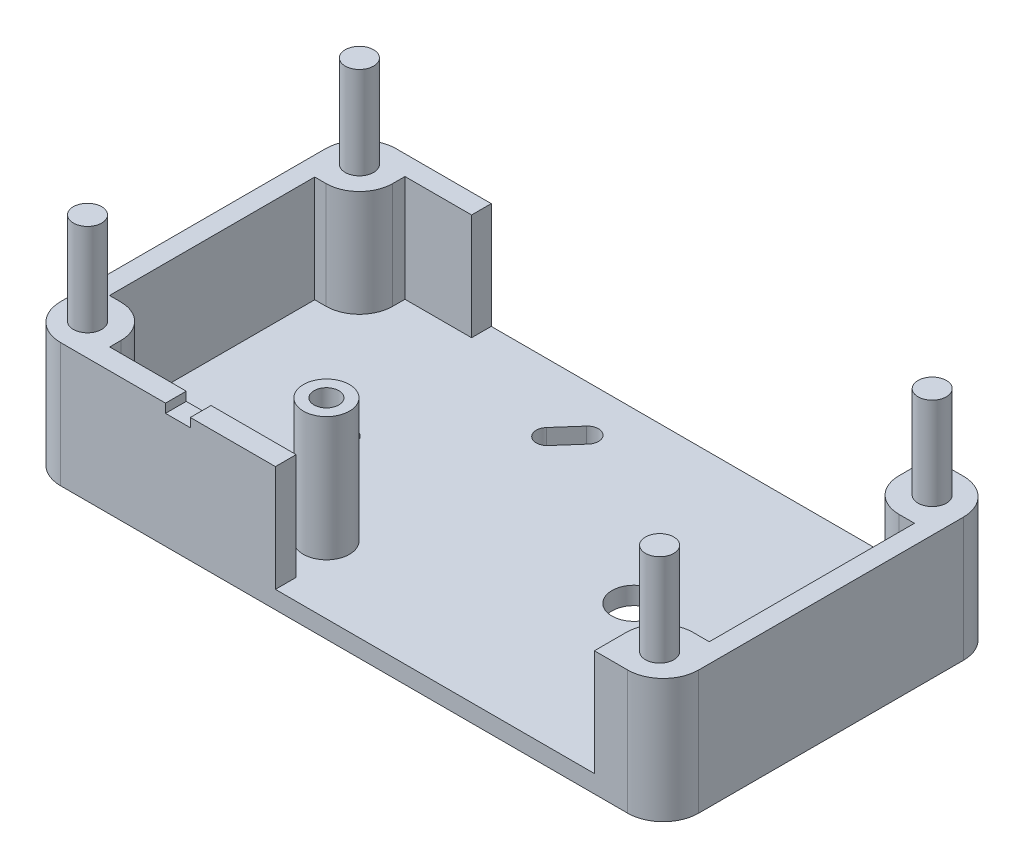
SolidWorks part; units mm, degrees
ref_plane "Front Plane" through (0, 0, 0) normal (0, 0, 1) x (1, 0, 0)
ref_plane "Top Plane" through (0, 0, 0) normal (0, 1, 0) x (1, 0, 0)
ref_plane "Right Plane" through (0, 0, 0) normal (1, 0, 0) x (0, 0, -1)
sketch "Sketch1" plane through (0, 0, 0) normal (0, 1, 0) x (1, 0, 0)
  line L1 (-22.86, 12.0269) -> (22.86, 12.0269)
  line L2 (-22.86, 12.0269) -> (-22.86, -12.0269)
  line L3 (-22.86, -12.0269) -> (22.86, -12.0269)
  line L4 (22.86, 12.0269) -> (22.86, -12.0269)
  line L5 (-22.86, 12.0269) -> (22.86, -12.0269) construction
  line L6 (-22.86, -12.0269) -> (22.86, 12.0269) construction
  point P0 (0, 0)
  dimension "D1" = 45.72
  dimension "D2" = 24.0538
extrude "Boss-Extrude1" add sketch "Sketch1" along normal blind 8.89
fillet "Fillet1" radius 2.54 4 edges at (22.86, 4.445, -12.0269) (-22.86, 4.445, -12.0269) (-22.86, 4.445, 12.0269) (22.86, 4.445, 12.0269)
sketch "Sketch2" plane through (0, 8.89, 0) normal (0, 1, 0) x (1, 0, 0)
  line L0 (-22.86, 9.4869) -> (-22.86, -9.4869) construction
  line L1 (-21.4884, 7.3533) -> (21.4884, 7.3533)
  line L2 (-21.4884, 7.3533) -> (-21.4884, -7.3533)
  line L3 (-21.4884, -7.3533) -> (21.4884, -7.3533)
  line L4 (21.4884, 7.3533) -> (21.4884, -7.3533)
  line L5 (-21.4884, 7.3533) -> (21.4884, -7.3533) construction
  line L6 (-21.4884, -7.3533) -> (21.4884, 7.3533) construction
  line L8 (20.32, 12.0269) -> (-20.32, 12.0269) construction
  point P0 (0, 0)
  dimension "D1" = 1.3716
  dimension "D2" = 4.6736
extrude "Cut-Extrude1" cut sketch "Sketch2" against normal blind 7.62
sketch "Sketch3" plane through (0, 0, -12.0269) normal (0, 0, -1) x (-1, 0, 0)
  line L0 (-20.32, 8.89) -> (-20.32, 0) construction
  line L5 (-20.32, 8.89) -> (20.32, 8.89) construction
  line L14 (-17.9832, 8.89) -> (13.5128, 8.89)
  line L15 (-17.9832, 8.89) -> (-17.9832, 1.27)
  line L16 (-17.9832, 1.27) -> (13.5128, 1.27)
  line L18 (13.5128, 1.27) -> (13.5128, 8.89)
  dimension "D1" = 31.496
  dimension "D4" = 2.3368
  dimension "D5" = 7.62
sketch "Sketch4" plane through (0, 0, 12.0269) normal (0, 0, 1) x (1, 0, 0)
  line L0 (-20.32, 8.89) -> (20.32, 8.89) construction
  line L9 (20.32, 0) -> (20.32, 8.89) construction
  line L10 (-4.9276, 8.89) -> (17.9324, 8.89)
  line L11 (-4.9276, 8.89) -> (-4.9276, 1.27)
  line L12 (-4.9276, 1.27) -> (17.9324, 1.27)
  line L13 (17.9324, 8.89) -> (17.9324, 1.27)
  dimension "D1" = 2.3876
  dimension "D2" = 22.86
  dimension "D3" = 7.62
extrude "Cut-Extrude3" cut sketch "Sketch4" against normal blind 7.366
extrude "Cut-Extrude4" cut sketch "Sketch3" against normal blind 7.366
fillet "Fillet3" radius 2.3876 2 edges at (17.9324, 5.08, 7.3533) (17.9832, 5.08, -7.3533)
sketch "Sketch5" plane through (0, 8.89, 0) normal (0, 1, 0) x (1, 0, 0)
  line L0 (-20.32, -12.0269) -> (-4.9276, -12.0269) construction
  line L1 (-18.288, 10.6172) -> (-3.048, 10.6172)
  line L2 (-18.288, 10.6172) -> (-18.288, -10.541)
  line L3 (-18.288, -10.541) -> (-3.048, -10.541)
  line L4 (-3.048, 10.6172) -> (-3.048, -10.541)
  line L5 (-22.86, 9.4869) -> (-22.86, -9.4869) construction
  line L6 (-13.5128, 7.3533) -> (-13.5128, 12.0269) construction
  dimension "D1" = 21.1582
  dimension "D2" = 1.4859
  dimension "D3" = 4.572
  dimension "D4" = 15.24
other "AlignGroup1"
extrude "Cut-Extrude5" cut sketch "Sketch5" against normal blind 7.62
fillet "Fillet4" radius 2.3876 2 edges at (-18.288, 5.08, -7.3533) (-18.288, 5.08, 7.3533)
sketch "Sketch6" plane through (0, 8.89, 0) normal (0, 1, 0) x (1, 0, 0)
  circle A0 centre (-20.6756, 9.7409) radius 1.016
  circle A2 centre (20.3708, 9.7409) radius 1.016
  circle A3 centre (20.32, -9.7409) radius 1.016
  circle A4 centre (-20.6756, -9.7409) radius 1.016
  dimension "D1" = 2.032
  dimension "D2" = 2.032
  dimension "D3" = 2.032
  dimension "D4" = 2.032
extrude "Boss-Extrude2" add sketch "Sketch6" along normal blind 6.604
sketch "Sketch7" plane through (0, 0, 12.0269) normal (0, 0, 1) x (1, 0, 0)
  line L0 (-20.32, 8.89) -> (-4.9276, 8.89) construction
  line L1 (-12.8016, 8.89) -> (-11.0236, 8.89)
  line L2 (-12.8016, 8.89) -> (-12.8016, 8.255)
  line L3 (-12.8016, 8.255) -> (-11.0236, 8.255)
  line L4 (-11.0236, 8.89) -> (-11.0236, 8.255)
  line L5 (-4.9276, 8.89) -> (-4.9276, 1.27) construction
  dimension "D1" = 1.778
  dimension "D2" = 6.096
  dimension "D3" = 0.635
extrude "Cut-Extrude6" cut sketch "Sketch7" against normal blind 26.67
sketch "Sketch8" plane through (0, 1.27, 0) normal (0, 1, 0) x (1, 0, 0)
  line L0 (21.4884, -7.3533) -> (21.4884, 7.3533) construction
  line L1 (17.9832, 12.0269) -> (-13.5128, 12.0269) construction
  circle A0 centre (8.7884, -0.0381) radius 1.5875
  dimension "D1" = 3.175
  dimension "D2" = 12.7
  dimension "D3" = 12.065
extrude "Cut-Extrude7" cut sketch "Sketch8" against normal blind 26.67
sketch "Sketch9" plane through (0, 1.27, 0) normal (0, 1, 0) x (1, 0, 0)
  line L0 (-4.6675, 7.2009) -> (-3.3235, 8.7249) construction
  line L1 (-5.2628, 7.7259) -> (-3.9188, 9.2499)
  line L2 (-4.0722, 6.6759) -> (-2.7282, 8.1999)
  line L4 (17.9832, 12.0269) -> (-13.5128, 12.0269) construction
  arc A0 (-5.2628, 7.7259) -> (-4.0722, 6.6759) centre (-4.6675, 7.2009) ccw
  arc A1 (-2.7282, 8.1999) -> (-3.9188, 9.2499) centre (-3.3235, 8.7249) ccw
  circle A2 centre (8.7884, -0.0381) radius 1.5875
  point P2 (-3.9955, 7.9629)
  dimension "D3" = 0.7937
  dimension "D6" = 3.175
  dimension "D1" = 2.032
  dimension "D2" = 15.0812
  dimension "D4" = 4.064
  dimension "D5" = 4.826
extrude "Cut-Extrude8" cut sketch "Sketch9" against normal blind 26.67
sketch "Sketch10" plane through (0, 1.27, 0) normal (0, 1, 0) x (1, 0, 0)
  line L0 (-3.9188, 9.2499) -> (-5.2628, 7.7259)
  line L1 (17.9832, 12.0269) -> (-13.5128, 12.0269) construction
  line L2 (-2.7282, 8.1999) -> (-4.0722, 6.6759)
  line L3 (-3.3235, 8.7249) -> (-3.9955, 7.9629)
  line L4 (-4.5908, 8.4879) -> (-3.4002, 7.4379)
  circle A0 centre (-11.9594, -0.0381) radius 0.7937
  arc A1 (-5.2628, 7.7259) -> (-4.0722, 6.6759) centre (-4.6675, 7.2009) ccw
  arc A2 (-3.9188, 9.2499) -> (-2.7282, 8.1999) centre (-3.3235, 8.7249) cw
  dimension "D1" = 1.5875
  dimension "D3" = 12.065
  dimension "D2" = 11.2889
extrude "Cut-Extrude9" cut sketch "Sketch10" against normal blind 26.67 contours A0
sketch "Sketch11" plane through (0, 1.27, 0) normal (0, 1, 0) x (1, 0, 0)
  line L0 (-22.86, 9.4869) -> (-22.86, -9.4869) construction
  line L1 (-4.9276, -12.0269) -> (17.9324, -12.0269) construction
  circle A0 centre (-6.096, -7.2009) radius 1.651
  circle A1 centre (-6.096, -7.2009) radius 0.889
  dimension "D3" = 3.302
  dimension "D4" = 1.778
  dimension "D1" = 16.764
  dimension "D2" = 4.826
extrude "Boss-Extrude3" add sketch "Sketch11" along normal blind 8.89
sketch "Sketch12" plane through (0, 1.27, 0) normal (0, 1, 0) x (1, 0, 0)
  circle A0 centre (-6.096, -7.2009) radius 0.889
  dimension "D1" = 1.778
extrude "Cut-Extrude10" cut sketch "Sketch12" against normal blind 7.62
ref_plane "Plane1" through (0, 4.318, 0) normal (0, 1, 0) x (1, 0, 0)
sketch "Sketch14" plane through (0, 4.318, 0) normal (0, 1, 0) x (1, 0, 0)
  line L0 (-4.5908, 8.4879) -> (-3.4002, 7.4379) construction
  line L1 (-3.9188, 9.2499) -> (-5.2628, 7.7259) construction
  line L2 (-4.0722, 6.6759) -> (-2.7282, 8.1999) construction
  circle A0 centre (8.7884, -0.0381) radius 11.1125
  circle A1 centre (-3.9955, 7.9629) radius 3.9688
  dimension "D1" = 22.225
  dimension "D2" = 7.9375
sketch "Sketch15" plane through (0, 4.318, 0) normal (0, 1, 0) x (1, 0, 0)
  circle A0 centre (-3.9955, 7.9629) radius 8.4667
  circle A1 centre (-11.9594, -0.0381) radius 3.6155
  dimension "D1" = 16.9333
  dimension "D2" = 7.2311
